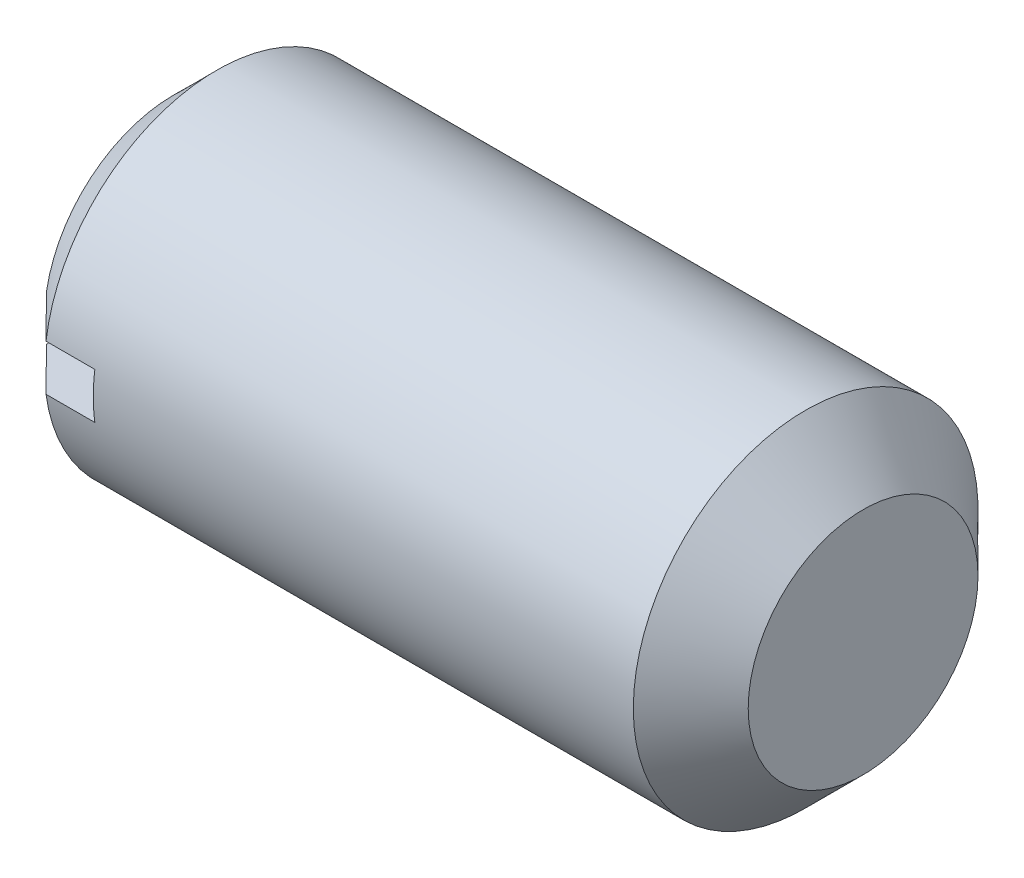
SolidWorks part; units mm, degrees
ref_plane "Front" through (0, 0, 0) normal (0, 0, 1) x (1, 0, 0)
ref_plane "Top" through (0, 0, 0) normal (0, 1, 0) x (1, 0, 0)
ref_plane "Right" through (0, 0, 0) normal (1, 0, 0) x (0, 0, -1)
other "Configuration Table"
sketch "Sketch1" plane through (0, 0, 0) normal (0, 0, 1) x (1, 0, 0)
  line L0 (0, 0) -> (6, 0)
  line L1 (6, 0) -> (6, 1)
  line L2 (6, 1) -> (5.5, 1.5)
  line L3 (5.5, 1.5) -> (0.375, 1.5)
  line L4 (0.375, 1.5) -> (0, 1.125)
  line L5 (0, 1.125) -> (0, 0)
  line L6 (-10.745, 0) -> (0.8952, 0) construction
revolve "Base" add sketch "Sketch1" angle 360 about L6
sketch "Sketch2" plane through (0, 0, 0) normal (0, 0, 1) x (1, 0, 0)
  line L1 (0, 0.2) -> (0.8, 0.2)
  line L2 (0, 0.2) -> (0, -0.2)
  line L3 (0, -0.2) -> (0.8, -0.2)
  line L4 (0.8, 0.2) -> (0.8, -0.2)
  line L5 (0, 1.125) -> (0, -1.125) construction
extrude "Notch" cut sketch "Sketch2" against normal through all and the other way through all
sketch "Sketch3" plane through (0, 0, 0) normal (0, 0, 1) x (1, 0, 0)
  line L0 (0.375, 1.1752) -> (0.5625, 1.5)
  line L1 (0.5625, 1.5) -> (0.5625, 1.875)
  line L2 (0.5625, 1.875) -> (0.1875, 1.875)
  line L3 (0.1875, 1.875) -> (0.1875, 1.5)
  line L4 (0.1875, 1.5) -> (0.375, 1.1752)
  line L5 (0, 0) -> (1.5288, 0) construction
  line L6 (0.375, 1.5) -> (0.375, 0.2) construction
revolve "Cut-Revolve10" [suppressed] cut sketch "Sketch3" angle 360 about L5
pattern_linear "LPattern10" [suppressed] count 13 spacing 0.45 along (1, 0, 0)
equation "\"df@Sketch1\" = \"D2@ThreadCosmetic1\""
equation "\"m@Sketch2\" = \"n@Sketch2\" / 2"
equation "\"D1@Sketch3\" = \"d@Sketch1\""
equation "\"D2@Sketch3\" =  ( \"d@Sketch1\" - \"D2@ThreadCosmetic1\" )  / 2"
equation "\"D3@LPattern10\" = \"D2@Sketch3\" * 1.2"
equation "\"D1@LPattern10\" =  ( \"l@Sketch1\" -  ( \"d@Sketch1\" - \"df@Sketch1\" )  / 2 )  / \"D3@LPattern10\""
